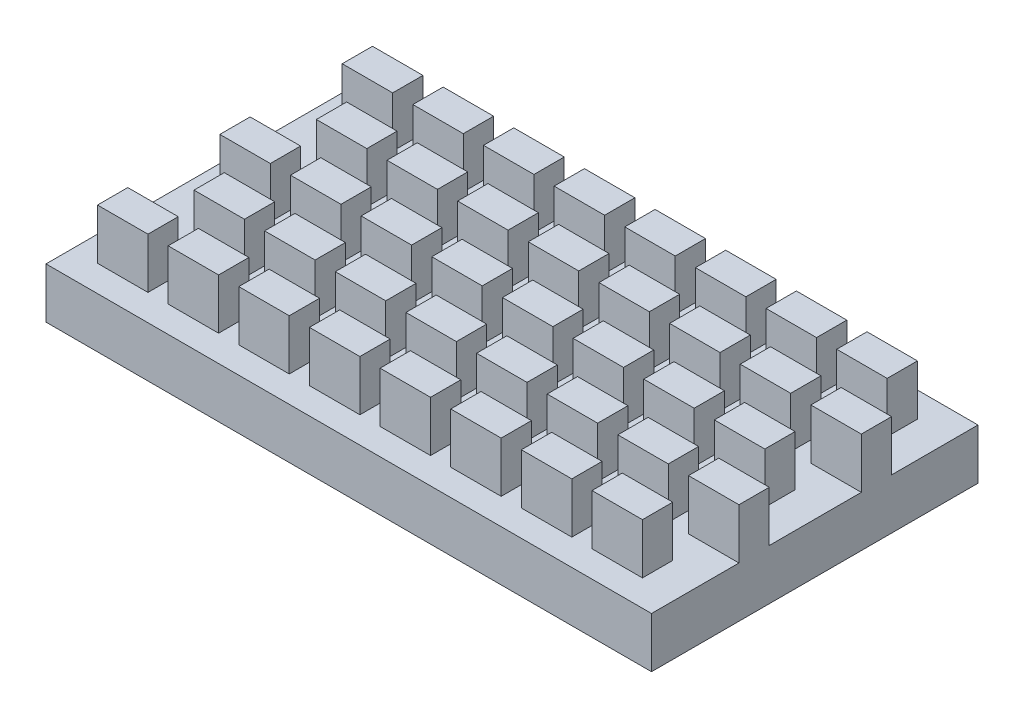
SolidWorks part; units mm, degrees
ref_plane "Front Plane" through (0, 0, 0) normal (0, 0, 1) x (1, 0, 0)
ref_plane "Top Plane" through (0, 0, 0) normal (0, 1, 0) x (1, 0, 0)
ref_plane "Right Plane" through (0, 0, 0) normal (1, 0, 0) x (0, 0, -1)
sketch "Sketch1" plane through (0, 0, 0) normal (0, 1, 0) x (1, 0, 0)
  line L1 (-76.2, 38.1) -> (76.2, 38.1)
  line L2 (-76.2, 38.1) -> (-76.2, -44.0729)
  line L3 (-76.2, -44.0729) -> (76.2, -44.0729)
  line L4 (76.2, 38.1) -> (76.2, -44.0729)
  dimension "D1" = 152.4
  dimension "D2" = 76.2
  dimension "D3" = 82.1729
  dimension "D4" = 44.0729
extrude "Extrude1" add sketch "Sketch1" along normal blind 12.7
sketch "Sketch2" plane through (0, 12.7, 0) normal (0, 1, 0) x (1, 0, 0)
  line L0 (-76.2, 38.1) -> (-76.2, -44.0729) construction
  line L1 (-69.85, 31.75) -> (-57.15, 31.75)
  line L2 (-69.85, 31.75) -> (-69.85, 24.13)
  line L3 (-69.85, 24.13) -> (-57.15, 24.13)
  line L4 (-57.15, 31.75) -> (-57.15, 24.13)
  line L5 (76.2, 38.1) -> (-76.2, 38.1) construction
  dimension "D1" = 12.7
  dimension "D2" = 7.62
  dimension "D3" = 6.35
  dimension "D4" = 6.35
extrude "Extrude2" add sketch "Sketch2" along normal blind 12.7
other "Fill Pattern1" parameters "D1"=17.78, "D2"=60, "D3"=0, "D7"=12, "D8"=6
